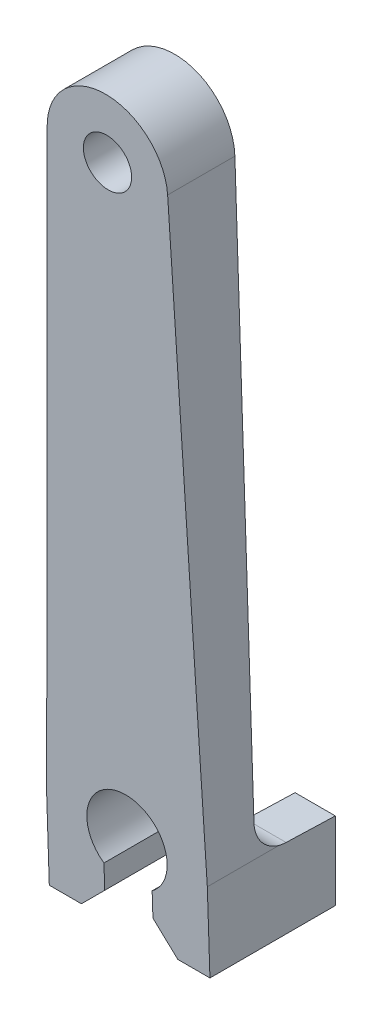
SolidWorks part; units mm, degrees
ref_plane "Front Plane" through (0, 0, 0) normal (0, 0, 1) x (1, 0, 0)
ref_plane "Top Plane" through (0, 0, 0) normal (0, 1, 0) x (1, 0, 0)
ref_plane "Right Plane" through (0, 0, 0) normal (1, 0, 0) x (0, 0, -1)
sketch "Sketch1" plane through (0, 0, 0) normal (0, 0, 1) x (1, 0, 0)
  line L0 (-10, -84.3) -> (-6, -84.3)
  line L1 (-10, -74.3) -> (-10, -84.3)
  line L3 (10, -74.3) -> (10, -84.3)
  line L4 (-3, -78.3) -> (-3, -81.3)
  line L5 (3, -78.3) -> (3, -81.3)
  line L6 (-7.4958, 0.2518) -> (-10, -74.3)
  line L7 (7.4958, 0.2518) -> (10, -74.3)
  line L14 (6, -84.3) -> (10, -84.3)
  line L18 (-3, -81.3) -> (-6, -84.3)
  line L20 (3, -81.3) -> (6, -84.3)
  arc A0 (7.4958, 0.2518) -> (-7.4958, 0.2518) centre (0, 0) ccw
  circle A1 centre (0, 0) radius 3
  arc A2 (3, -78.3) -> (-3, -78.3) centre (0, -74.3) ccw
  dimension "D1" = 15
  dimension "D2" = 6
  dimension "D7" = 10
  dimension "D3" = 84.3
  dimension "D4" = 20
  dimension "D5" = 10
  dimension "D6" = 74.3
  dimension "D9" = 10
  dimension "D8" = 20
extrude "Boss-Extrude1" add sketch "Sketch1" along normal blind 8.61
sketch "Sketch2" plane through (0, 0, 0) normal (1, 0, 0) x (0, 0, -1)
  line L2 (-8.61, 7.5) -> (-5.61, -84.3)
  line L3 (-8.61, -74.3) -> (-8.61, -84.3)
  line L4 (-8.61, -84.3) -> (-8.8124, -84.2124)
  line L5 (-8.61, -84.3) -> (0, -84.3) construction
  line L6 (-8.61, -84.3) -> (-5.61, -84.3)
  line L7 (-8.61, 0.2518) -> (-8.61, -74.3) construction
  line L8 (-8.61, 0.2518) -> (-8.61, -74.3)
  line L9 (-8.61, 7.5) -> (-8.61, 0.2518) construction
  line L10 (-8.61, 7.5) -> (-8.61, 0.2518)
extrude "Cut-Extrude2" cut sketch "Sketch2" against normal mid plane 39.61 contours L2 L10 L8 L3 L6
sketch "Sketch4" plane through (0, 0, 0) normal (0, 0, -1) x (-1, 0, 0)
  line L0 (10, -74.3) -> (10, -84.3) construction
  line L1 (-10, -74.3) -> (-10, -84.3) construction
  line L2 (-6, -84.3) -> (-10, -84.3) construction
  line L3 (-3, -81.3) -> (-6, -84.3) construction
  line L4 (-3, -78.3) -> (-3, -81.3) construction
  line L5 (3, -78.3) -> (3, -81.3) construction
  line L6 (3, -81.3) -> (6, -84.3) construction
  line L7 (10, -84.3) -> (6, -84.3) construction
  line L8 (10, -74.3) -> (10, -84.3)
  line L9 (-10, -74.3) -> (-10, -84.3)
  line L10 (-6, -84.3) -> (-10, -84.3)
  line L11 (-3, -81.3) -> (-6, -84.3)
  line L12 (-3, -78.3) -> (-3, -81.3)
  line L13 (3, -78.3) -> (3, -81.3)
  line L14 (3, -81.3) -> (6, -84.3)
  line L15 (10, -84.3) -> (6, -84.3)
  line L16 (-10, -74.3) -> (-5, -74.3)
  line L17 (5, -74.3) -> (10, -74.3)
  arc A0 (3, -78.3) -> (-3, -78.3) centre (0, -74.3) ccw construction
  arc A1 (3, -78.3) -> (5, -74.3) centre (0, -74.3) ccw
  arc A2 (-5, -74.3) -> (-3, -78.3) centre (0, -74.3) ccw
extrude "Boss-Extrude2" add sketch "Sketch4" along normal blind 10
sketch "Sketch5" plane through (10, 0, 0) normal (1, 0, 0) x (0, 0, -1)
  line L0 (0, -74.3) -> (10, -74.6265)
  line L1 (0, 0.2518) -> (0, -74.3) construction
  line L2 (10, -74.3) -> (0, -74.3) construction
  line L3 (10, -74.3) -> (0, -74.3)
  line L4 (10, -74.3) -> (10, -84.3) construction
  line L5 (10, -74.3) -> (10, -74.6265)
  dimension "D1" = 91.87
extrude "Cut-Extrude3" cut sketch "Sketch5" against normal blind 27
fillet "Fillet1" radius 4 2 edges at (7.5, -74.3, 0)
